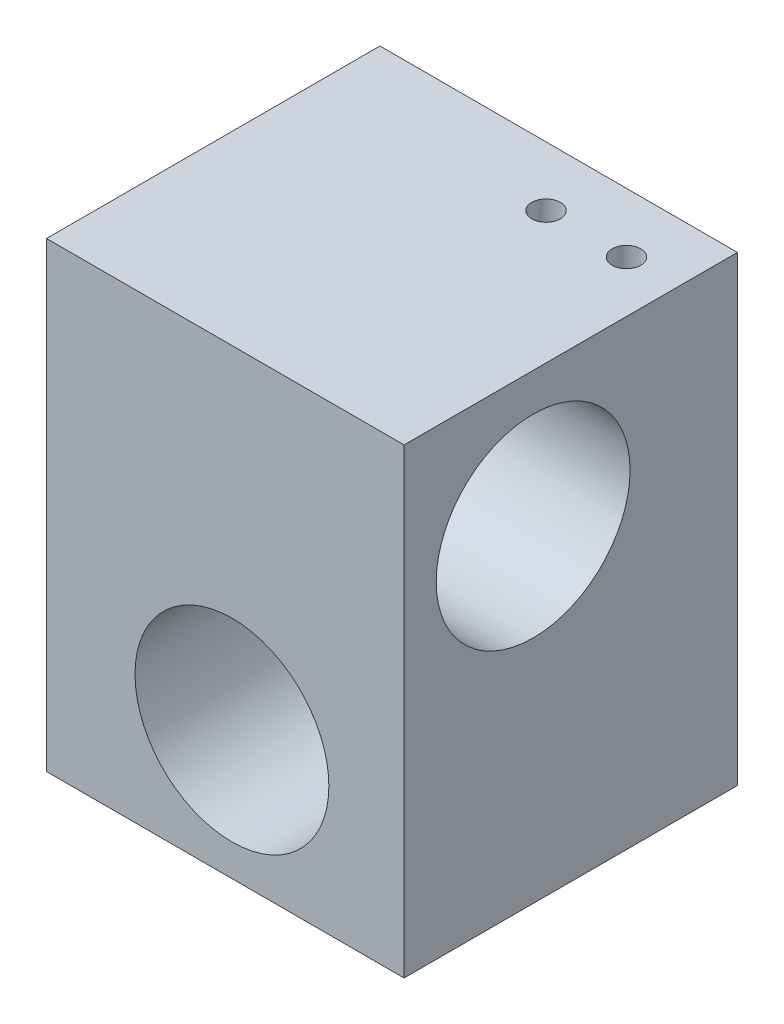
SolidWorks part; units mm, degrees
ref_plane "Front Plane" through (0, 0, 0) normal (0, 0, 1) x (1, 0, 0)
ref_plane "Top Plane" through (0, 0, 0) normal (0, 1, 0) x (1, 0, 0)
ref_plane "Right Plane" through (0, 0, 0) normal (1, 0, 0) x (0, 0, -1)
sketch "Sketch1" plane through (0, 0, 0) normal (0, 1, 0) x (1, 0, 0)
  line L1 (-10.9199, -8.1114) -> (14.4801, -8.1114)
  line L2 (-10.9199, -8.1114) -> (-10.9199, 17.2886)
  line L3 (-10.9199, 17.2886) -> (14.4801, 17.2886)
  line L4 (14.4801, -8.1114) -> (14.4801, 17.2886)
  dimension "D1" = 25.4
  dimension "D2" = 25.4
extrude "Boss-Extrude1" add sketch "Sketch1" along normal blind 28.7
sketch "Sketch2" plane through (0, 0, 8.1114) normal (0, 0, 1) x (1, 0, 0)
  line L2 (-10.9199, 0) -> (14.4801, 0) construction
  line L4 (1.7801, 28.7) -> (1.7801, 0) construction
  line L5 (-10.9199, 28.7) -> (14.4801, 28.7) construction
  circle A0 centre (3.7801, 8) radius 6.0254
  dimension "D1" = 8
  dimension "D3" = 12.0508
  dimension "D2" = 2
sketch "Sketch3" plane through (14.4801, 0, 0) normal (1, 0, 0) x (0, 0, -1)
  line L0 (4.5886, 28.7) -> (4.5886, 0) construction
  line L1 (-8.1114, 28.7) -> (17.2886, 28.7) construction
  line L2 (-8.1114, 0) -> (17.2886, 0) construction
  line L3 (-8.1114, 8) -> (17.2886, 8) construction
  line L4 (-8.1114, 14.0254) -> (-8.1114, 1.9746) construction
  line L5 (17.2886, 28.7) -> (17.2886, 0) construction
  circle A0 centre (4.5886, 20.319) radius 6.025
  dimension "D1" = 12.319
  dimension "D3" = 12.05
  dimension "D2" = 8
extrude "Cut-Extrude1" cut sketch "Sketch2" against normal through all
extrude "Cut-Extrude2" cut sketch "Sketch3" against normal through all
sketch "Sketch4" plane through (0, 28.7, 0) normal (0, 1, 0) x (1, 0, 0)
  line L0 (-10.9199, 13.5886) -> (14.4801, 13.5886) construction
  line L1 (3.0501, 17.2886) -> (3.0501, 25.4371) construction
  line L4 (-10.9199, 17.2886) -> (-10.9199, -8.1114) construction
  line L5 (14.4801, -8.1114) -> (14.4801, 17.2886) construction
  line L6 (1.7801, 17.2886) -> (1.7801, -8.1114) construction
  line L7 (-10.9199, -4.4114) -> (14.4801, -4.4114) construction
  line L9 (-10.9199, -8.1114) -> (14.4801, -8.1114) construction
  line L10 (11.2801, -8.1114) -> (11.2801, 17.2886) construction
  line L11 (14.4801, 17.2886) -> (-10.9199, 17.2886) construction
  line L12 (-10.5199, 4.5886) -> (14.4801, 4.5886) construction
  line L13 (6.2801, -8.1114) -> (6.2801, 17.2886) construction
  circle A0 centre (6.2801, 13.5886) radius 0.5412
  circle A1 centre (11.2801, 13.5886) radius 0.5782
  circle A2 centre (1.7801, -4.4114) radius 0.5921 construction
  dimension "D1" = 9.5
  dimension "D2" = 4.5
  dimension "D3" = 9
  dimension "D4" = 9
  dimension "D5" = 11.43
  dimension "D6" = 3.2
  dimension "D7" = 3.23
hole_wizard "#2-56 Tapped Hole1" positions "Sketch6" profile "Sketch5" tap size "#2-56" standard "ANSI Inch"
sketch "Sketch6" plane through (0, 28.7, 0) normal (0, 1, 0) x (1, 0, 0)
  point P0 (6.2801, 13.5886)
  point P3 (11.2801, 13.5886)
sketch "Sketch5" plane through (6.2801, 28.7, -13.5886) normal (1, 0, 0) x (0, 0, 1)
  line L0 (0, 0) -> (0, 7.189)
  line L1 (0, 7.189) -> (0.889, 6.6548)
  line L2 (0.889, 6.6548) -> (0.889, 0)
  line L5 (0.889, 0) -> (0, 0)
  line L10 (0, 7.189) -> (-0.889, 6.6548) construction
  line L11 (0, -6.35) -> (0, 107.95) construction
  dimension "Tap Drill Dia." = 1.778
  dimension "Tap Drill Depth" = 6.6548
  dimension "Drill Angle" = 118
sketch "Sketch7" plane through (0, 0, 0) normal (0, -1, 0) x (1, 0, 0)
  line L0 (1.7801, 8.1114) -> (1.7801, -17.2886) construction
  line L1 (-10.9199, 8.1114) -> (14.4801, 8.1114) construction
  line L2 (14.4801, -17.2886) -> (-10.9199, -17.2886) construction
  line L3 (-10.9199, -12.0886) -> (14.4801, -12.0886) construction
  line L4 (14.4801, 8.1114) -> (14.4801, -17.2886) construction
  line L5 (14.4801, -4.5886) -> (-10.9199, -4.5886) construction
  line L6 (-10.9199, -17.2886) -> (-10.9199, 8.1114) construction
  line L7 (11.7801, 8.1114) -> (11.7801, -17.2886) construction
  line L8 (-10.9199, 4.4114) -> (14.4801, 4.4114) construction
  line L9 (-4.2199, 8.1114) -> (-4.2199, -17.2886) construction
  circle A0 centre (11.7801, 4.4114) radius 0.4277 construction
  circle A1 centre (11.7801, -12.0886) radius 0.6504
  circle A2 centre (-4.2199, 4.4114) radius 0.6438 construction
  circle A3 centre (-4.2199, -12.0886) radius 0.4564
  dimension "D2" = 10
sketch "Sketch10" plane through (0, 28.7, 0) normal (0, 1, 0) x (1, 0, 0)
  line L0 (-7.7449, -3.4364) -> (14.4801, -3.4364)
  line L2 (14.4801, -8.1114) -> (14.4801, 17.2886) construction
  line L3 (-10.9199, -1.4364) -> (14.4801, -1.4364) construction
  line L4 (-10.9199, -8.1114) -> (14.4801, -8.1114) construction
  line L5 (-10.9199, 17.2886) -> (-10.9199, -8.1114)
  line L6 (-10.9199, -8.1114) -> (14.4801, -8.1114)
  line L7 (14.4801, -8.1114) -> (14.4801, -3.4364)
  line L9 (-10.9199, 17.2886) -> (-7.7449, 17.2886)
  line L12 (-7.7449, 17.2886) -> (-7.7449, -3.4364)
  dimension "D1" = 2
  dimension "D2" = 4.675
  dimension "D3" = 3.175
extrude "Cut-Extrude3" cut sketch "Sketch10" against normal through all
sketch "Sketch12" plane through (0, 0, 0) normal (0, -1, 0) x (1, 0, 0)
  line L0 (-2.2453, -17.2886) -> (-2.2453, 3.4364) construction
  line L1 (-7.7449, -10.6136) -> (-7.7449, 1.4364) construction
  line L2 (-7.7449, 1.4364) -> (14.4801, 1.4364) construction
  line L3 (9.8055, 3.4364) -> (9.8055, -17.2886) construction
  line L4 (-7.7449, -10.6136) -> (14.4801, -10.6136) construction
  line L5 (-2.2453, -17.2886) -> (-7.7449, -17.2886) construction
  line L6 (-3.9349, -13.5886) -> (-3.9349, -3.5886) construction
  line L7 (9.8055, -17.2886) -> (-2.2453, -17.2886) construction
  line L8 (3.7801, -17.2886) -> (3.7801, 6.2232) construction
  line L9 (14.4801, 1.4364) -> (14.4801, -10.6136) construction
  line L10 (14.4801, -4.5886) -> (-10.4587, -4.5886) construction
  circle A0 centre (-3.9349, -3.5886) radius 0.508
  circle A1 centre (-3.9349, -13.5886) radius 0.508
  dimension "D4" = 1.016
  dimension "D5" = 1.016
  dimension "D1" = 9
  dimension "D2" = 1
  dimension "D3" = 3.81
  dimension "D6" = 7.715
  dimension "D7" = 11.525
hole_wizard "#2-56 Tapped Hole2" positions "Sketch14" profile "Sketch15" tap size "#2-56" standard "ANSI Inch"
sketch "Sketch14" plane through (0, 0, 0) normal (0, -1, 0) x (-1, 0, 0)
  point P0 (3.9349, 13.5886)
  point P3 (3.9349, 3.5886)
sketch "Sketch15" plane through (-3.9349, 0, -13.5886) normal (1, 0, 0) x (0, 0, -1)
  line L0 (0, 0) -> (0, 7.189)
  line L1 (0, 7.189) -> (0.889, 6.6548)
  line L2 (0.889, 6.6548) -> (0.889, 0)
  line L5 (0.889, 0) -> (0, 0)
  line L10 (0, 7.189) -> (-0.889, 6.6548) construction
  line L11 (0, -6.35) -> (0, 107.95) construction
  dimension "Tap Drill Dia." = 1.778
  dimension "Tap Drill Depth" = 6.6548
  dimension "Drill Angle" = 118
sketch "Sketch16" [suppressed] plane through (0, 28.7, 0) normal (0, 1, 0) x (1, 0, 0)
  line L0 (-7.7449, -1.4364) -> (14.4801, 10.6136) construction
  line L1 (14.4801, 10.6136) -> (-7.7449, 10.6136) construction
  line L2 (-7.7449, 10.6136) -> (14.4801, -1.4364) construction
  line L3 (3.3676, 4.5886) -> (-12.3595, 4.5886) construction
  line L5 (14.4801, 17.2886) -> (-7.7449, 17.2886) construction
  dimension "D1" = 12.7
